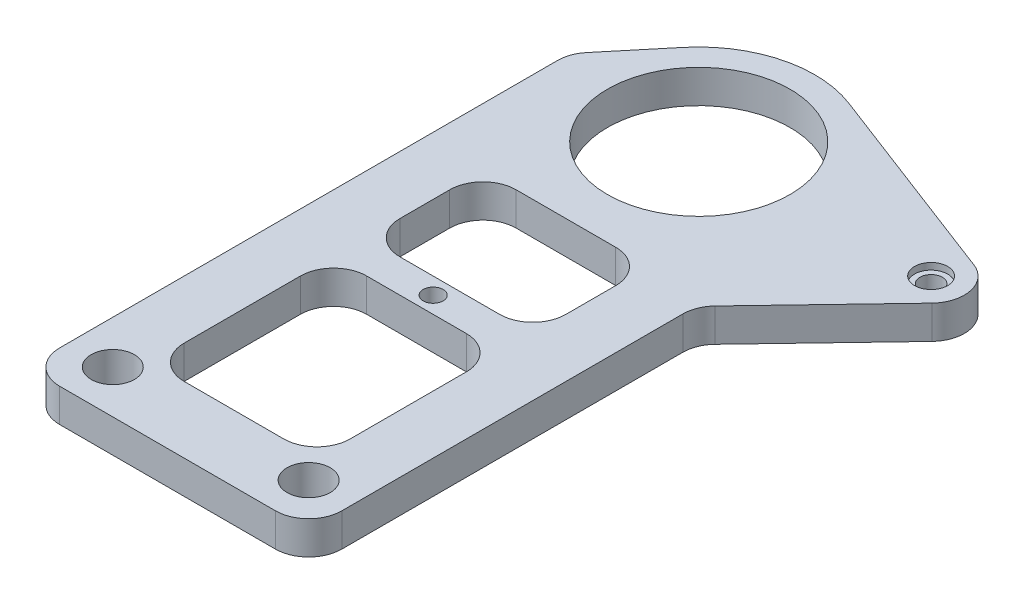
SolidWorks part; units mm, degrees
ref_plane "Plan1" through (0, 0, 0) normal (0, 0, 1) x (1, 0, 0)
ref_plane "Plan2" through (0, 0, 0) normal (0, 1, 0) x (1, 0, 0)
ref_plane "Plan3" through (0, 0, 0) normal (1, 0, 0) x (0, 0, -1)
sketch "Esquisse1" plane through (0, 0, 0) normal (0, 1, 0) x (1, 0, 0)
  line L0 (0, -125.2958) -> (0, 16.3192) construction
  line L1 (-48.3796, 0) -> (124.4123, 0) construction
  line L2 (70, -23.0429) -> (70, 21.0961) construction
  line L3 (-42.5, -150) -> (-42.5, 0)
  line L4 (73.5714, 9.3405) -> (12.5, 32.6917)
  line L5 (45.2683, -40.3744) -> (77.2317, -6.9067)
  line L6 (32.5, -160) -> (-32.5, -160)
  line L7 (-15, -75) -> (15, -75)
  line L8 (42.5, -150) -> (42.5, -47.2811)
  line L9 (-53.4152, -80) -> (60.419, -80) construction
  line L10 (25, -130) -> (25, -95)
  line L11 (-40.1923, 6.3897) -> (-26.9231, 22.364)
  line L12 (-25, -95) -> (-25, -130)
  line L13 (-15, -85) -> (15, -85)
  line L14 (-15, -140) -> (15, -140)
  line L16 (-25, -65) -> (-25, -50)
  line L19 (25, -50) -> (25, -65)
  line L20 (15, -40) -> (-15, -40)
  circle A0 centre (70, 0) radius 2.5
  arc A1 (77.2317, -6.9067) -> (73.5714, 9.3405) centre (70, 0) ccw
  arc A2 (42.5, -47.2811) -> (45.2683, -40.3744) centre (52.5, -47.2811) cw
  arc A3 (15, -75) -> (25, -65) centre (15, -65) ccw
  circle A4 centre (0, 0) radius 27
  arc A5 (-15, -75) -> (-25, -65) centre (-15, -65) cw
  arc A6 (-15, -85) -> (-25, -95) centre (-15, -95) ccw
  arc A7 (12.5, 32.6917) -> (-26.9231, 22.364) centre (0, 0) ccw
  circle A8 centre (29.5, -147) radius 6.3
  circle A9 centre (-29.5, -147) radius 6.3
  arc A10 (-32.5, -160) -> (-42.5, -150) centre (-32.5, -150) cw
  arc A11 (32.5, -160) -> (42.5, -150) centre (32.5, -150) ccw
  arc A12 (15, -85) -> (25, -95) centre (15, -95) cw
  arc A13 (-40.1923, 6.3897) -> (-42.5, 0) centre (-32.5, 0) ccw
  arc A14 (15, -140) -> (25, -130) centre (15, -130) ccw
  arc A15 (-15, -140) -> (-25, -130) centre (-15, -130) cw
  circle A16 centre (0, -80) radius 2.9
  arc A18 (25, -50) -> (15, -40) centre (15, -50) ccw
  arc A19 (-25, -50) -> (-15, -40) centre (-15, -50) cw
  dimension "D1" = 20
  dimension "D2" = 59
  dimension "D3" = 70
  dimension "D4" = 147
  dimension "D9" = 12.6
  dimension "D10" = 10
  dimension "D11" = 10
  dimension "D12" = 35
  dimension "D13" = 85
  dimension "D6" = 10
  dimension "D7" = 10
  dimension "D8" = 54
  dimension "D5" = 5
  dimension "D15" = 80
  dimension "D18" = 10
  dimension "D23" = 10
  dimension "D20" = 5.8
  dimension "D14" = 46.317
  dimension "D16" = 50
  dimension "D17" = 40
  dimension "D19" = 160
extrude "Base-Extrusion" add sketch "Esquisse1" along normal blind 10
sketch "Esquisse2" plane through (0, 0, 0) normal (0, 1, 0) x (1, 0, 0)
  circle A0 centre (0, 0) radius 27.5
  circle A1 centre (0, -80) radius 3
  circle A2 centre (29.5, -147) radius 6.5
  circle A3 centre (-29.5, -147) radius 6.5
  circle A4 centre (-29.5, -147) radius 6.3 construction
  circle A5 centre (29.5, -147) radius 6.3 construction
  dimension "D1" = 55
  dimension "D2" = 6
  dimension "D3" = 13
extrude "Enlèv. mat.-Extru.2" cut sketch "Esquisse2" along normal through all
sketch "Esquisse3" plane through (0, 10, 0) normal (0, 1, 0) x (-1, 0, 0)
  circle A0 centre (-70, 0) radius 5
  dimension "D1" = 10
extrude "Enlèv. mat.-Extru.3" cut sketch "Esquisse3" against normal blind 2
sketch "Esquisse4" plane through (0, 10, 0) normal (0, 1, 0) x (-1, 0, 0)
  circle A0 centre (-70, 0) radius 3.375
  circle A1 centre (-70, 0) radius 2.5 construction
  dimension "D1" = 6.75
extrude "Enlèv. mat.-Extru.4" cut sketch "Esquisse4" against normal through all
